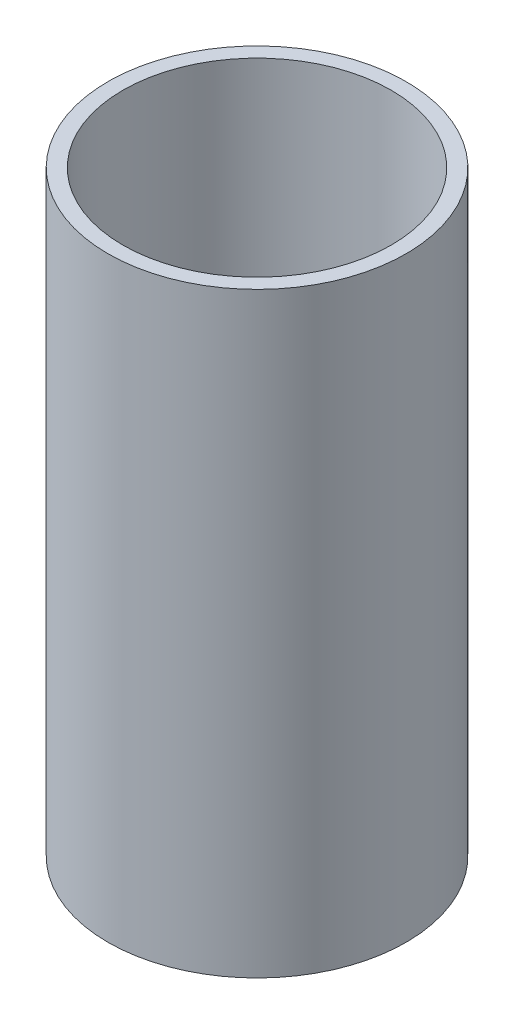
SolidWorks part; units mm, degrees
ref_plane "Plan de face" through (0, 0, 0) normal (0, 0, 1) x (1, 0, 0)
ref_plane "Plan de dessus" through (0, 0, 0) normal (0, 1, 0) x (1, 0, 0)
ref_plane "Plan de droite" through (0, 0, 0) normal (1, 0, 0) x (0, 0, -1)
sketch "Esquisse1" plane through (0, 0, 0) normal (0, 1, 0) x (1, 0, 0)
  circle A0 centre (0, 0) radius 15
  circle A1 centre (0, 0) radius 13.5
  dimension "D1" = 30
  dimension "D2" = 27
extrude "Extrusion1" add sketch "Esquisse1" along normal blind 60
